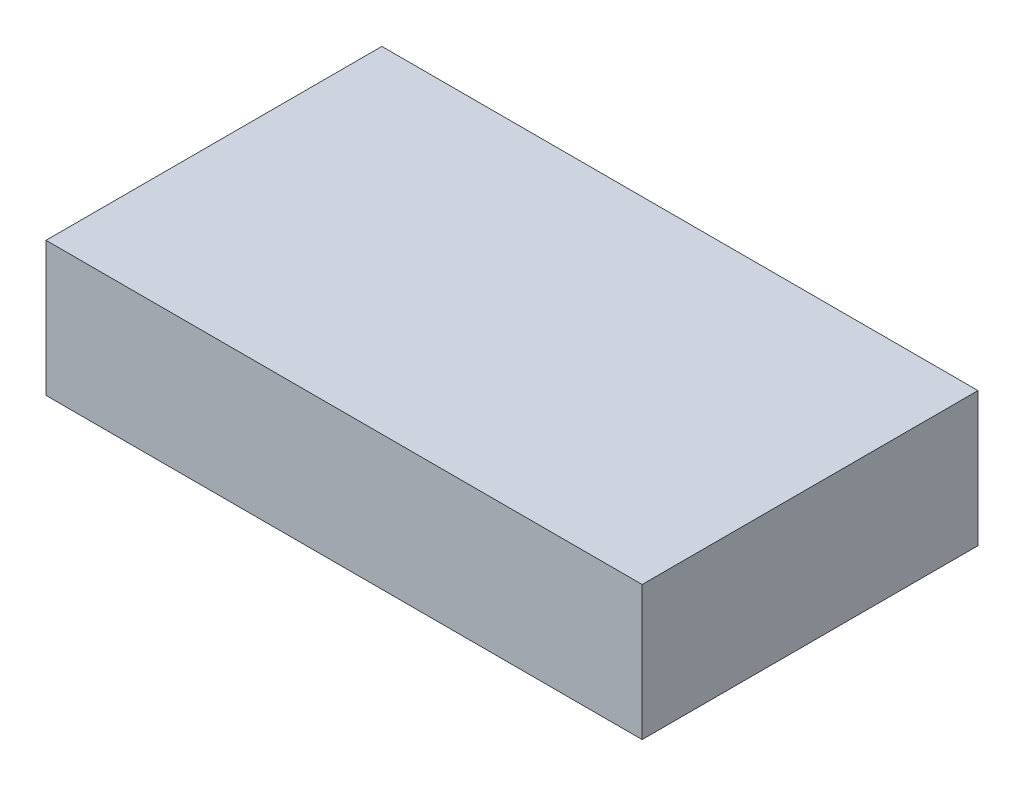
SolidWorks part; units mm, degrees
ref_plane "Front Plane" through (0, 0, 0) normal (0, 0, 1) x (1, 0, 0)
ref_plane "Top Plane" through (0, 0, 0) normal (0, 1, 0) x (1, 0, 0)
ref_plane "Right Plane" through (0, 0, 0) normal (1, 0, 0) x (0, 0, -1)
other "Configuration Table"
sketch "草图1" plane through (0, 0, 0) normal (0, 1, 0) x (1, 0, 0)
  line L1 (-15.9567, 7.5096) -> (19.5433, 7.5096)
  line L2 (-15.9567, 7.5096) -> (-15.9567, -12.4904)
  line L3 (-15.9567, -12.4904) -> (19.5433, -12.4904)
  line L4 (19.5433, 7.5096) -> (19.5433, -12.4904)
  dimension "D1" = 35.5
  dimension "D2" = 20
extrude "凸台-拉伸1" add sketch "草图1" along normal blind 8
